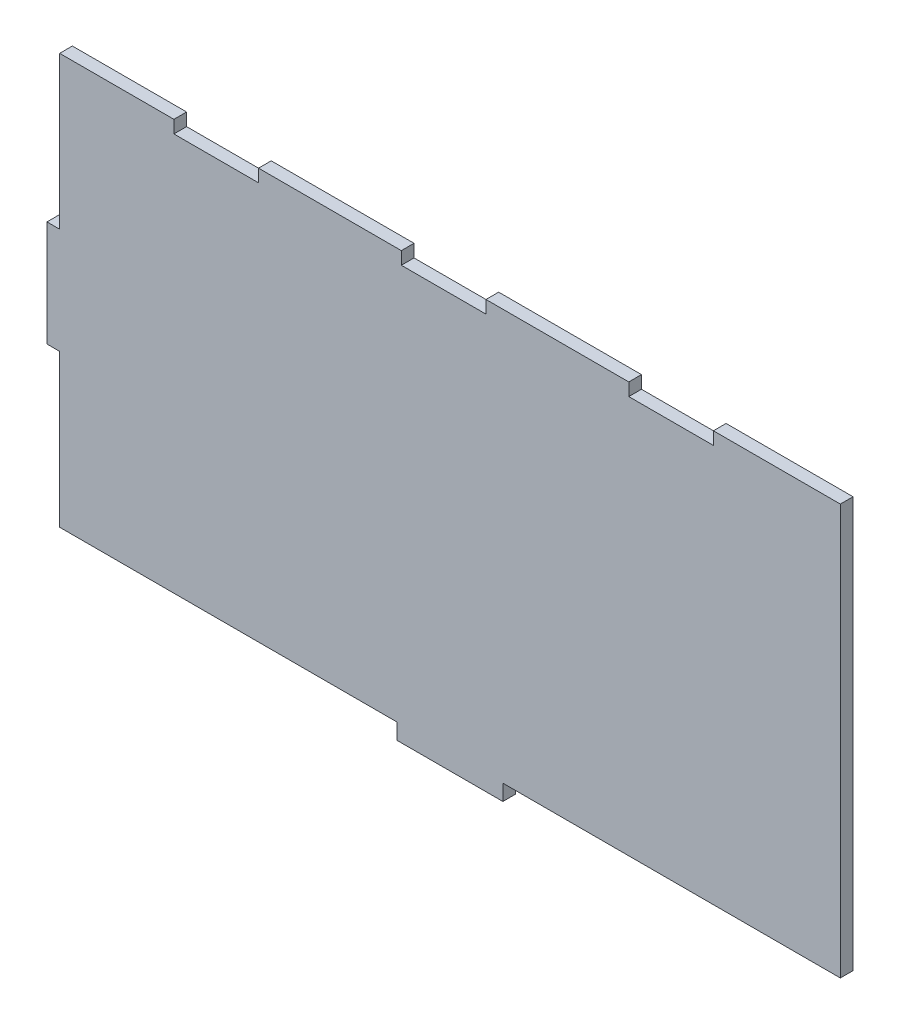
SolidWorks part; units mm, degrees
ref_plane "Alzado" through (0, 0, 0) normal (0, 0, 1) x (1, 0, 0)
ref_plane "Planta" through (0, 0, 0) normal (0, 1, 0) x (1, 0, 0)
ref_plane "Vista lateral" through (0, 0, 0) normal (1, 0, 0) x (0, 0, -1)
sketch "Croquis1" plane through (0, 0, 0) normal (0, 0, 1) x (1, 0, 0)
  line L5 (-261, 194) -> (-369, 194)
  line L6 (369, -194) -> (50, -194)
  line L26 (369, -194) -> (369, 194)
  line L27 (369, 194) -> (249, 194)
  line L28 (-369, -194) -> (-369, -50)
  line L29 (369, -194) -> (-369, 194) construction
  line L30 (369, 194) -> (-369, -194) construction
  line L32 (-261, 194) -> (-261, 182)
  line L33 (-261, 182) -> (-181, 182)
  line L34 (-181, 194) -> (-181, 182)
  line L36 (-46, 194) -> (-46, 182)
  line L37 (-46, 182) -> (34, 182)
  line L38 (34, 194) -> (34, 182)
  line L40 (169, 194) -> (169, 182)
  line L41 (169, 182) -> (249, 182)
  line L42 (249, 194) -> (249, 182)
  line L43 (-46, 194) -> (-181, 194)
  line L44 (169, 194) -> (34, 194)
  line L45 (-369, 50) -> (-369, 194)
  line L46 (-369, 50) -> (-381, 50)
  line L48 (-369, -50) -> (-381, -50)
  line L49 (-381, 50) -> (-381, -50)
  line L50 (-50, -194) -> (-369, -194)
  line L52 (50, -194) -> (50, -209)
  line L53 (50, -209) -> (-50, -209)
  line L54 (-50, -194) -> (-50, -209)
  line L55 (0, -194) -> (-50, -209) construction
  line L56 (50, -209) -> (0, -194) construction
  point P0 (0, 0)
  point P5 (0, -194)
  point P22 (-381, 0)
  point P25 (0, 0)
  dimension "D2" = 388
  dimension "D3" = 108
  dimension "D4" = 80
  dimension "D5" = 135
  dimension "D6" = 80
  dimension "D7" = 135
  dimension "D8" = 80
  dimension "D9" = 12
  dimension "D10" = 12
  dimension "D11" = 100
  dimension "D12" = 750
  dimension "D13" = 15
  dimension "D14" = 100
  dimension "D15" = 319
extrude "Saliente-Extruir2" add sketch "Croquis1" along normal blind 12
